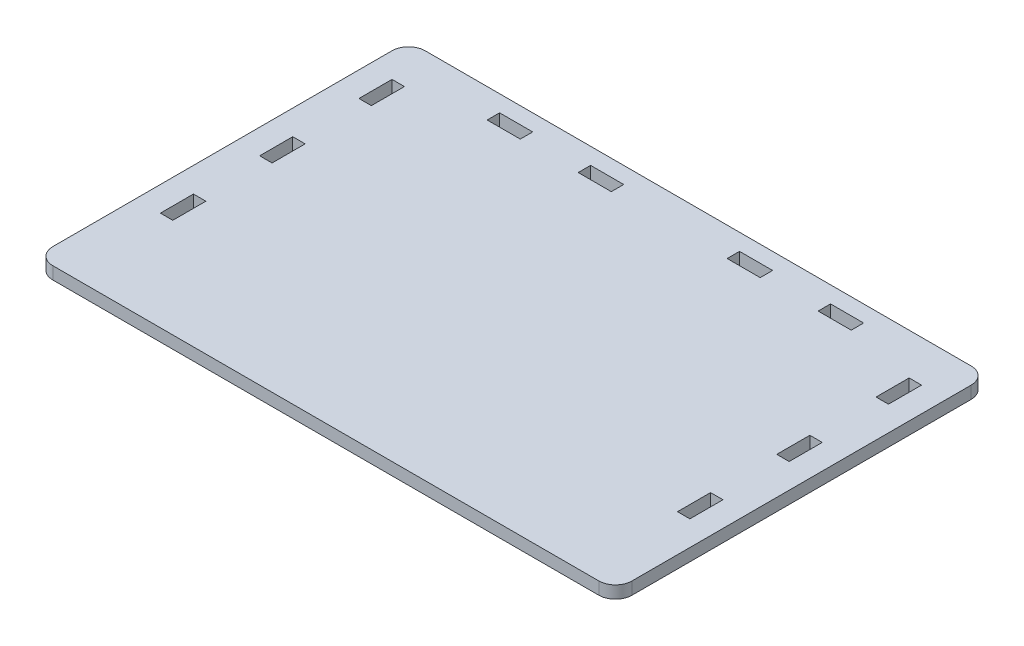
SolidWorks part; units mm, degrees
ref_plane "Alzado" through (0, 0, 0) normal (0, 0, 1) x (1, 0, 0)
ref_plane "Planta" through (0, 0, 0) normal (0, 1, 0) x (1, 0, 0)
ref_plane "Vista lateral" through (0, 0, 0) normal (1, 0, 0) x (0, 0, -1)
sketch "Croquis1" plane through (0, 0, 0) normal (0, 1, 0) x (1, 0, 0)
  line L1 (-350, -225) -> (350, -225)
  line L2 (-350, -225) -> (-350, 225)
  line L3 (-350, 225) -> (350, 225)
  line L4 (350, -225) -> (350, 225)
  line L5 (-350, -225) -> (350, 225) construction
  line L6 (-350, 225) -> (350, -225) construction
  point P0 (0, 0)
  dimension "D1" = 700
  dimension "D2" = 450
extrude "Saliente-Extruir1" add sketch "Croquis1" along normal blind 15
fillet "Redondeo1" radius 20 4 edges at (-350, 7.5, -225) (350, 7.5, -225) (350, 7.5, 225) (-350, 7.5, 225)
sketch "Croquis2" plane through (0, 0, 0) normal (0, 1, 0) x (1, 0, 0)
  line L0 (-320, 225) -> (-320, -190.0108) construction
  line L1 (330, 225) -> (-330, 225) construction
  line L2 (-350, 205) -> (-350, -205) construction
  line L3 (0, 191.8229) -> (0, -182.8466) construction
  line L4 (-235.8758, 205) -> (256.9084, 205) construction
  line L5 (320, 175) -> (305, 175)
  line L6 (-220, 205) -> (-180, 205)
  line L7 (-220, 205) -> (-220, 190)
  line L8 (-220, 190) -> (-180, 190)
  line L9 (-180, 205) -> (-180, 190)
  line L10 (-110, 205) -> (-70, 205)
  line L11 (-110, 205) -> (-110, 190)
  line L12 (-110, 190) -> (-70, 190)
  line L13 (-70, 205) -> (-70, 190)
  line L14 (70, 205) -> (110, 205)
  line L15 (70, 205) -> (70, 190)
  line L16 (70, 190) -> (110, 190)
  line L17 (110, 205) -> (110, 190)
  line L18 (180, 205) -> (220, 205)
  line L19 (180, 205) -> (180, 190)
  line L20 (180, 190) -> (220, 190)
  line L21 (220, 205) -> (220, 190)
  line L22 (-320, 175) -> (-305, 175)
  line L23 (-320, 175) -> (-320, 135)
  line L24 (-320, 135) -> (-305, 135)
  line L25 (-305, 175) -> (-305, 135)
  line L26 (-320, 55) -> (-305, 55)
  line L27 (-320, 55) -> (-320, 15)
  line L28 (-320, 15) -> (-305, 15)
  line L29 (-305, 55) -> (-305, 15)
  line L30 (-320, -65) -> (-305, -65)
  line L31 (-320, -65) -> (-320, -105)
  line L32 (-320, -105) -> (-305, -105)
  line L33 (-305, -65) -> (-305, -105)
  line L34 (320, -65) -> (305, -65)
  line L35 (320, -65) -> (320, -105)
  line L36 (305, -65) -> (305, -105)
  line L37 (320, -105) -> (305, -105)
  line L38 (320, 55) -> (320, 15)
  line L39 (320, 15) -> (305, 15)
  line L40 (305, 55) -> (305, 15)
  line L41 (320, 55) -> (305, 55)
  line L42 (320, 175) -> (320, 135)
  line L43 (320, 135) -> (305, 135)
  line L44 (305, 175) -> (305, 135)
  dimension "D1" = 30
  dimension "D2" = 20
  dimension "D3" = 15
  dimension "D4" = 15
  dimension "D5" = 15
  dimension "D6" = 15
  dimension "D7" = 15
  dimension "D8" = 15
  dimension "D9" = 15
  dimension "D10" = 40
  dimension "D11" = 40
  dimension "D12" = 40
  dimension "D13" = 80
  dimension "D14" = 80
  dimension "D15" = 30
  dimension "D16" = 40
  dimension "D17" = 40
  dimension "D18" = 40
  dimension "D19" = 40
  dimension "D20" = 70
  dimension "D21" = 70
  dimension "D22" = 70
  dimension "D23" = 70
extrude "Cortar-Extruir1" cut sketch "Croquis2" along normal blind 15
